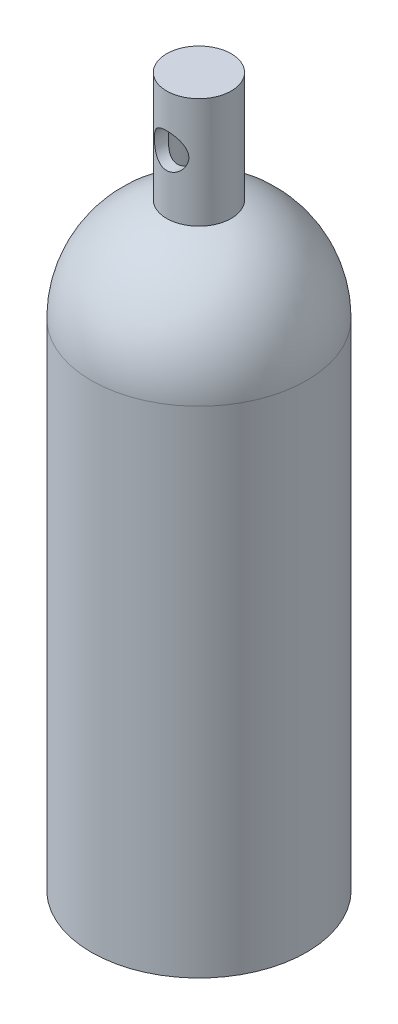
SolidWorks part; units mm, degrees
ref_plane "Front Plane" through (0, 0, 0) normal (0, 0, 1) x (1, 0, 0)
ref_plane "Top Plane" through (0, 0, 0) normal (0, 1, 0) x (1, 0, 0)
ref_plane "Right Plane" through (0, 0, 0) normal (1, 0, 0) x (0, 0, -1)
sketch "Sketch_Toothpaste Tank" plane through (0, 0, 0) normal (0, 1, 0) x (1, 0, 0)
  circle A0 centre (0, 0) radius 50
  dimension "D1" = 100
extrude "Toothpaste Tank" add sketch "Sketch_Toothpaste Tank" against normal blind 230
shell "Shell_Tank Space" thickness 5
sketch "Sketch_Tank Top" plane through (0, 0, 0) normal (1, 0, 0) x (0, 0, -1)
  line L0 (0, 0) -> (0, 45) construction
  line L1 (0, 48.9898) -> (0, 50) construction
  line L2 (0, 0) -> (-45, 0) construction
  line L3 (-10, 48.9898) -> (0, 48.9898) construction
  line L4 (0, 45) -> (0, 48.9898) construction
  line L5 (-45, 0) -> (-50, 0)
  line L8 (-10, 48.9898) -> (-10, 43.8748)
  line L9 (-10, 48.9898) -> (-10, 93.8748)
  line L10 (-10, 98.9898) -> (-15, 98.9898)
  line L11 (-15, 98.9898) -> (-15, 47.697)
  line L12 (-10, 98.9898) -> (0, 98.9898)
  line L13 (0, 98.9898) -> (0, 93.8748)
  line L14 (0, 93.8748) -> (-10, 93.8748)
  line L15 (-10, 93.8748) -> (-10, 98.9898) construction
  arc A0 (-50, 0) -> (-15, 47.697) centre (0, 0) cw
  arc A1 (-10, 48.9898) -> (0, 50) centre (0, 0) cw construction
  arc A2 (-45, 0) -> (-10, 43.8748) centre (0, 0) cw
  arc A3 (-10, 43.8748) -> (0, 45) centre (0, 0) cw construction
  arc A4 (-15, 47.697) -> (-10, 48.9898) centre (0, 0) cw construction
  point P3 (0, 92.1328)
  point P18 (-10, 92.7652)
  point P20 (0, 0)
  dimension "D1" = 10
  dimension "D2" = 50
  dimension "D3" = 5
revolve "Revolve_Tank Top" add sketch "Sketch_Tank Top" angle 360 about L1
sketch "Sketch_Valve" plane through (0, 0, 0) normal (0, 0, 1) x (1, 0, 0)
  line L1 (0, 0) -> (0, 75) construction
  circle A1 centre (0, 75) radius 8
  dimension "D2" = 16
  dimension "D1" = 75
extrude "Cut_Valve" cut sketch "Sketch_Valve" along normal up to next
